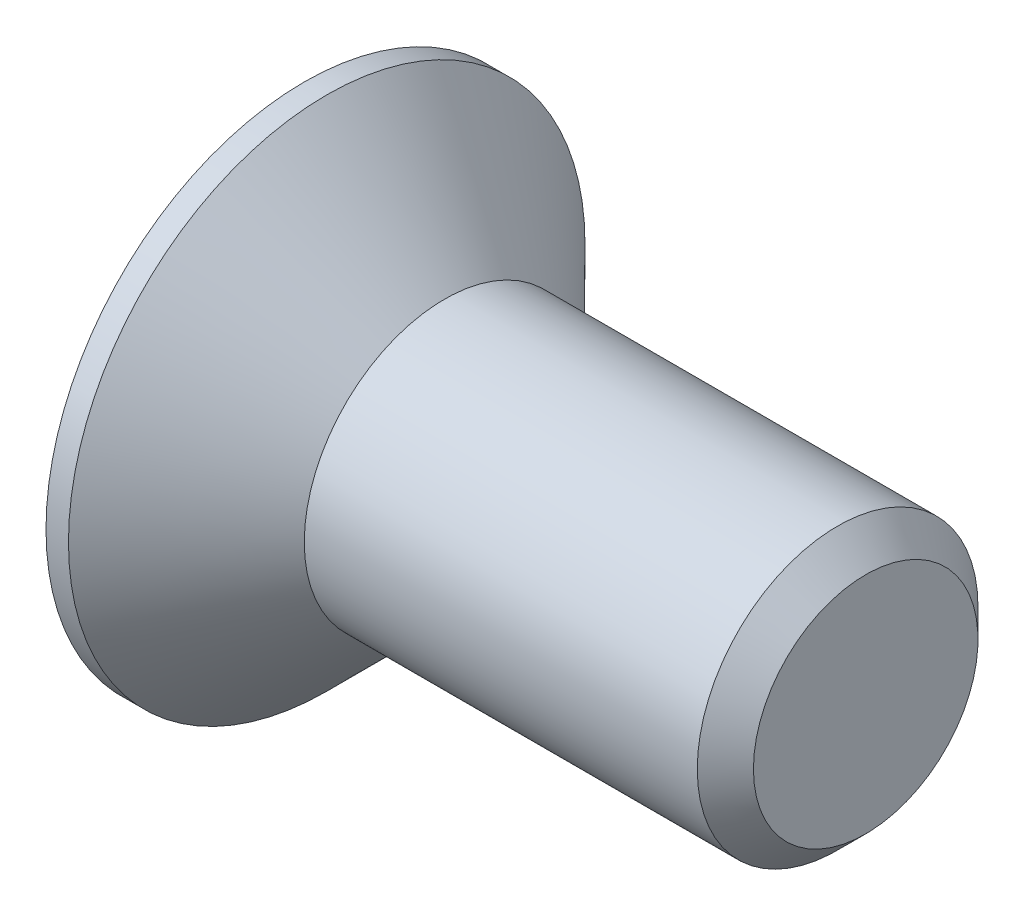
SolidWorks part; units mm, degrees
ref_plane "Front Plane" through (0, 0, 0) normal (0, 0, 1) x (1, 0, 0)
ref_plane "Top Plane" through (0, 0, 0) normal (0, 1, 0) x (1, 0, 0)
ref_plane "Right Plane" through (0, 0, 0) normal (1, 0, 0) x (0, 0, -1)
sketch "Sketch1" plane through (0, 0, 0) normal (0, 0, 1) x (1, 0, 0)
  line L1 (-2.5, 4.6) -> (-2.5, 0)
  line L2 (-2.5, 0) -> (7.5, 0)
  line L3 (7.5, 0) -> (7.5, 2.5)
  line L4 (7.5, 2.5) -> (0, 2.5)
  line L5 (-2.5, 4.6) -> (-2.1, 4.6)
  line L6 (-2.1, 4.6) -> (0, 2.5)
  dimension "D1" = 2.5
  dimension "D2" = 45
  dimension "D3" = 2.5
  dimension "D4" = 10
  dimension "D5" = 4.6
revolve "Revolve1" add sketch "Sketch1" angle 360 about L2
chamfer "Chamfer1" distance 0.5 angle 45 1 edges at (7.5, 0, 2.5)
sketch "Sketch2" plane through (-2.5, 0, 0) normal (-1, 0, 0) x (0, 0, 1)
  line L0 (-0.575, 2.3) -> (0.575, 2.3)
  line L1 (0.575, 2.3) -> (0.575, 0.575)
  line L2 (0.575, 0.575) -> (2.3, 0.575)
  line L3 (2.3, 0.575) -> (2.3, -0.575)
  line L4 (2.3, -0.575) -> (0.575, -0.575)
  line L5 (0.575, -0.575) -> (0.575, -2.3)
  line L6 (0.575, -2.3) -> (-0.575, -2.3)
  line L7 (-0.575, -2.3) -> (-0.575, -0.575)
  line L8 (-0.575, -0.575) -> (-2.3, -0.575)
  line L9 (-2.3, -0.575) -> (-2.3, 0.575)
  line L10 (-2.3, 0.575) -> (-0.575, 0.575)
  line L11 (-0.575, 0.575) -> (-0.575, 2.3)
  point P2 (0, 2.3)
  point P14 (0, -2.3)
  point P15 (2.3, 0)
  point P16 (-2.3, 0)
  dimension "D1" = 4.6
  dimension "D2" = 1.15
extrude "Cut-Extrude1" cut sketch "Sketch2" against normal blind 2.1
